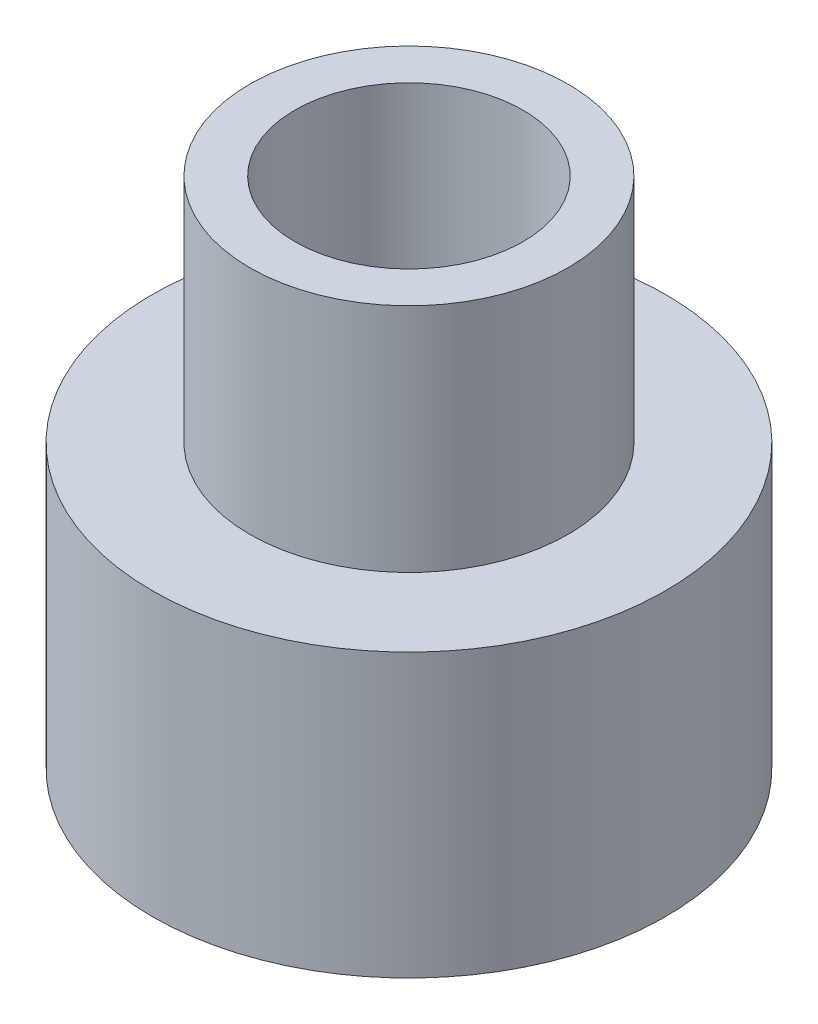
SolidWorks part; units mm, degrees
ref_plane "Front Plane" through (0, 0, 0) normal (0, 0, 1) x (1, 0, 0)
ref_plane "Top Plane" through (0, 0, 0) normal (0, 1, 0) x (1, 0, 0)
ref_plane "Right Plane" through (0, 0, 0) normal (1, 0, 0) x (0, 0, -1)
sketch "Sketch3" plane through (0, 0, 0) normal (0, 1, 0) x (1, 0, 0)
  circle A0 centre (0, 0) radius 2
extrude "Boss-Extrude2" add sketch "Sketch3" along normal blind 2.2
sketch "Sketch4" plane through (0, 2.2, 0) normal (0, 1, 0) x (1, 0, 0)
  circle A0 centre (0, 0) radius 1.24
extrude "Boss-Extrude3" add sketch "Sketch4" along normal blind 1.8
sketch "Sketch6" plane through (0, 4, 0) normal (0, 1, 0) x (1, 0, 0)
  point P0 (0, 0)
sketch "Sketch10" plane through (0, 0, 0) normal (0, -1, 0) x (1, 0, 0)
  point P0 (0, 0)
hole_wizard "#2-56 Tapped Hole1" positions "Sketch12" profile "Sketch11" tap size "#2-56" standard "ANSI Inch"
sketch "Sketch12" plane through (0, 4, 0) normal (0, 1, 0) x (1, 0, 0)
  point P0 (0, 0)
sketch "Sketch11" plane through (0, 4, 0) normal (1, 0, 0) x (0, 0, 1)
  line L0 (0, 0) -> (0, 3.7092)
  line L1 (0, 3.7092) -> (0.889, 3.175)
  line L2 (0.889, 3.175) -> (0.889, 0)
  line L5 (0.889, 0) -> (0, 0)
  line L10 (0, 3.7092) -> (-0.889, 3.175) construction
  line L11 (0, -6.35) -> (0, 107.95) construction
  dimension "Tap Drill Dia." = 1.778
  dimension "Tap Drill Depth" = 3.175
  dimension "Drill Angle" = 118
